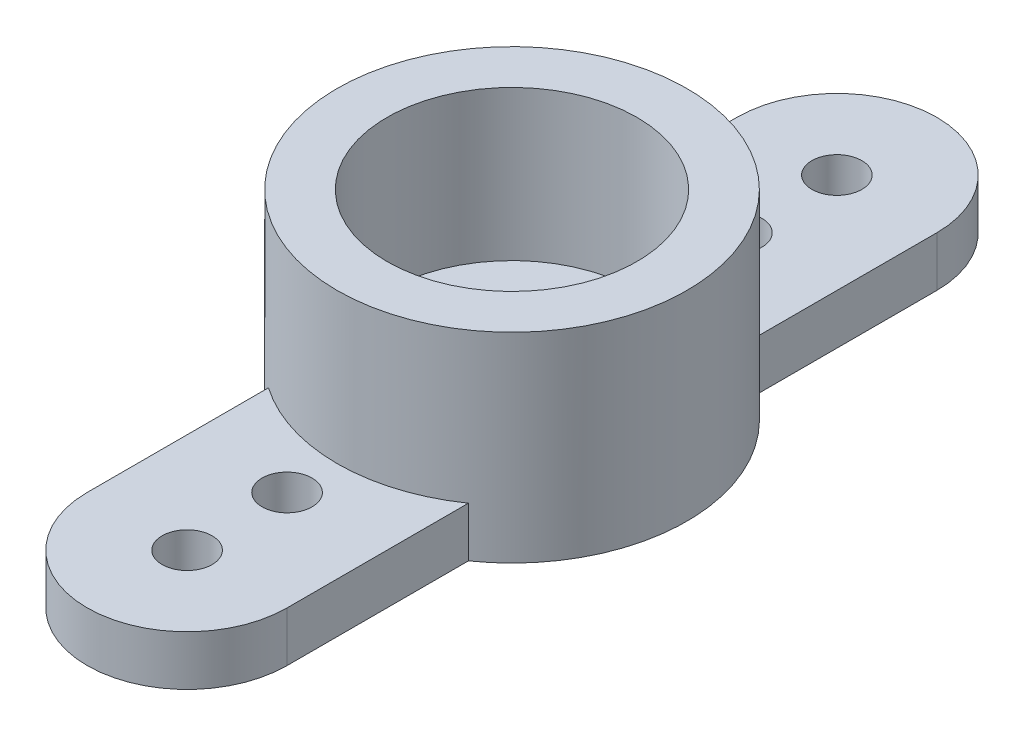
SolidWorks part; units mm, degrees
ref_plane "Front Plane" through (0, 0, 0) normal (0, 0, 1) x (1, 0, 0)
ref_plane "Top Plane" through (0, 0, 0) normal (0, 1, 0) x (1, 0, 0)
ref_plane "Right Plane" through (0, 0, 0) normal (1, 0, 0) x (0, 0, -1)
sketch "Sketch1" plane through (0, 0, 0) normal (0, 1, 0) x (1, 0, 0)
  circle A0 centre (0, 0) radius 3.5
  circle A1 centre (0, 0) radius 2.5
  dimension "D1" = 1
  dimension "D2" = 7
extrude "Boss-Extrude1" add sketch "Sketch1" along normal blind 4
sketch "Sketch2" plane through (0, 0, 0) normal (0, 1, 0) x (1, 0, 0)
  line L0 (-2, 2.8723) -> (-2, 6.5)
  line L1 (2, 6.5) -> (2, 2.8723)
  line L2 (-3.5, 0) -> (3.5, 0) construction
  line L3 (2, -6.5) -> (2, -2.8723)
  line L4 (-2, -2.8723) -> (-2, -6.5)
  circle A0 centre (0, 0) radius 3.5 construction
  arc A1 (-2, 6.5) -> (2, 6.5) centre (0, 6.5) cw
  arc A2 (-2, -6.5) -> (2, -6.5) centre (0, -6.5) ccw
  circle A3 centre (0, 0) radius 2.5 construction
  circle A4 centre (0, 0) radius 2.5
  arc A5 (-2, -2.8723) -> (2, -2.8723) centre (0, 0) ccw
  arc A6 (2, 2.8723) -> (-2, 2.8723) centre (0, 0) ccw
  point P16 (0, 8.5)
  point P17 (0, -8.5)
  dimension "D1" = 2
  dimension "D2" = 17
extrude "Boss-Extrude2" add sketch "Sketch2" along normal blind 1
sketch "Sketch3" plane through (0, 1, 0) normal (0, 1, 0) x (1, 0, 0)
  line L0 (-3.5, 0) -> (3.5, 0) construction
  circle A0 centre (0, 6.5) radius 0.5
  circle A1 centre (0, 4.5) radius 0.5
  circle A2 centre (0, 0) radius 3.5 construction
  circle A3 centre (0, -4.5) radius 0.5
  circle A4 centre (0, -6.5) radius 0.5
  dimension "D1" = 1
  dimension "D2" = 2
extrude "Cut-Extrude1" cut sketch "Sketch3" against normal through all
